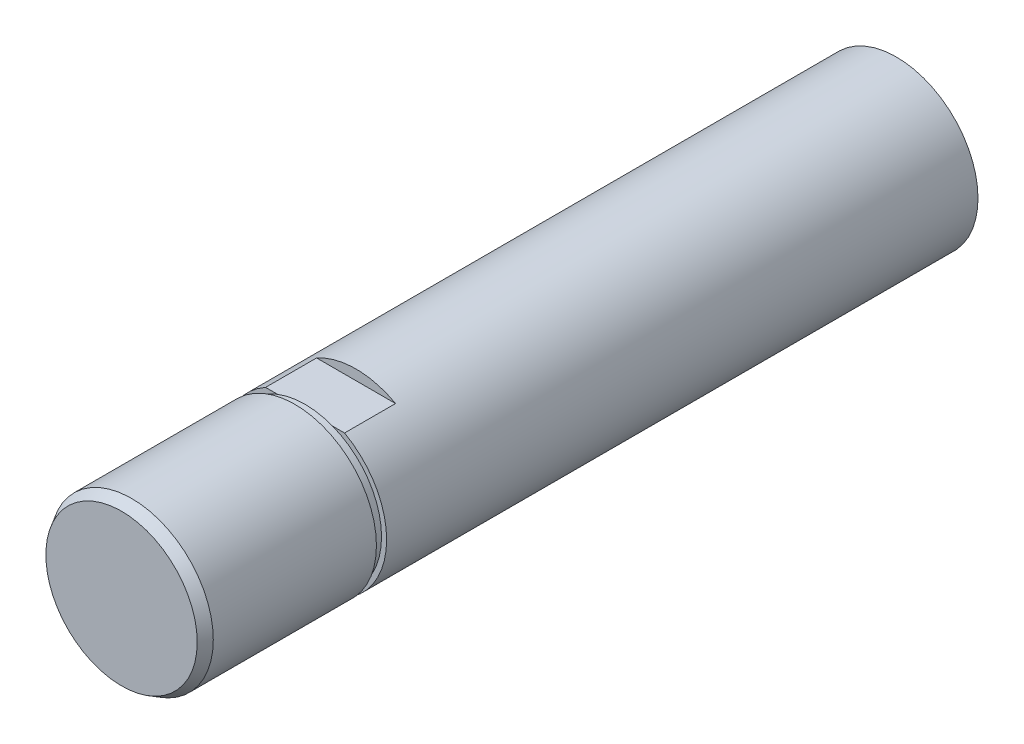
SolidWorks part; units mm, degrees
ref_plane "Front Plane" through (0, 0, 0) normal (0, 0, 1) x (1, 0, 0)
ref_plane "Top Plane" through (0, 0, 0) normal (0, 1, 0) x (1, 0, 0)
ref_plane "Right Plane" through (0, 0, 0) normal (1, 0, 0) x (0, 0, -1)
ref_plane "Plane1" through (0, 0, 8) normal (0, 0, 1) x (1, 0, 0)
sketch "Sketch1" plane through (0, 0, 0) normal (0, 0, 1) x (1, 0, 0)
  circle A0 centre (0, 0) radius 8
  dimension "D1" = 16
extrude "STROKE" add sketch "Sketch1" against normal blind 50
sketch "Sketch2" plane through (0, 0, 0) normal (0, 0, 1) x (1, 0, 0)
  circle A0 centre (0, 0) radius 8
  dimension "D1" = 16
extrude "L2" add sketch "Sketch2" along normal blind 8
sketch "Sketch3" plane through (0, 0, 8) normal (0, 0, 1) x (1, 0, 0)
  circle A0 centre (0, 0) radius 8
  dimension "D1" = 16
extrude "L3" add sketch "Sketch3" along normal blind 18
chamfer "Chamfer2" distance 1 angle 30 1 edges at (8, 0, 26)
sketch "Sketch5" plane through (0, 0, 8) normal (0, 0, 1) x (1, 0, 0)
  circle A0 centre (0, 0) radius 8
  circle A1 centre (0, 0) radius 7.5
  circle A4 centre (0, 0) radius 8 construction
  dimension "D1" = 16
  dimension "D2" = 15
extrude "U/C" cut sketch "Sketch5" along normal blind 1
sketch "Sketch6" plane through (0, 0, 0) normal (1, 0, 0) x (0, 0, -1)
  line L1 (-8, 10.3815) -> (-3, 10.3815)
  line L2 (-8, -7) -> (-8, -11.2121)
  line L3 (-8, 7) -> (-3, 7)
  line L4 (-3, 10.3815) -> (-3, 7)
  line L5 (-8, -7) -> (-3, -7)
  line L6 (-8, 10.3815) -> (-8, 7)
  line L7 (-8, -11.2121) -> (-3, -11.2121)
  line L8 (-3, -7) -> (-3, -11.2121)
  line L10 (50, 0) -> (-8, 0) construction
  line L11 (-8, 7.5) -> (-8, -7.5) construction
  dimension "D1" = 5
  dimension "D2" = 14
  dimension "D3" = 7
extrude "A/F" cut sketch "Sketch6" against normal mid plane 21
equation "\"D2@Sketch5\" = \"D1@Sketch5\" - 1"
